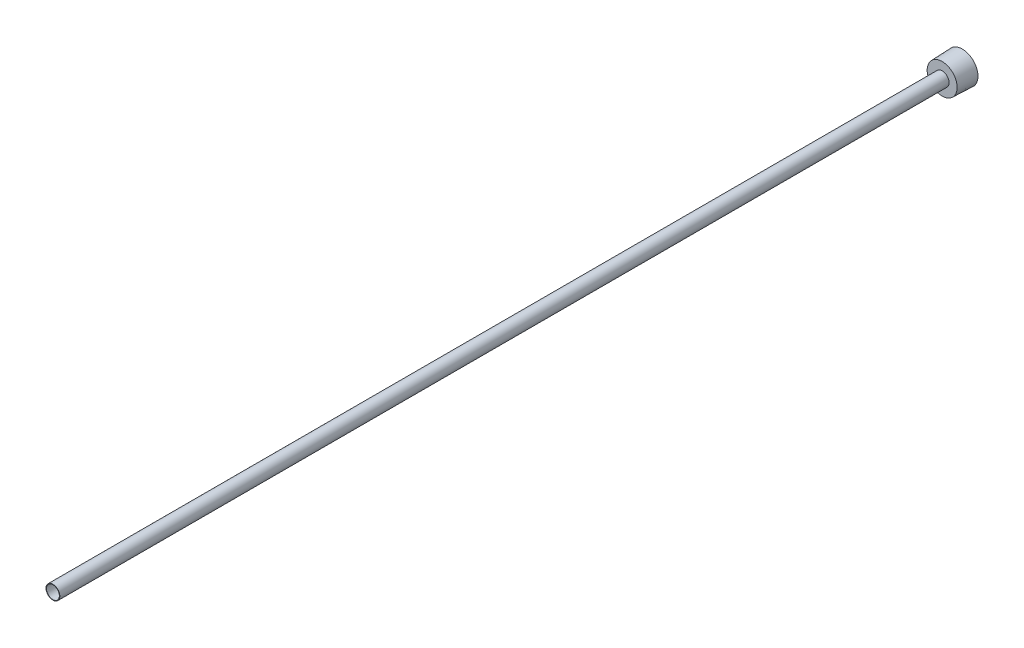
SolidWorks part; units mm, degrees
ref_plane "Front Plane" through (0, 0, 0) normal (0, 0, 1) x (1, 0, 0)
ref_plane "Top Plane" through (0, 0, 0) normal (0, 1, 0) x (1, 0, 0)
ref_plane "Right Plane" through (0, 0, 0) normal (1, 0, 0) x (0, 0, -1)
sketch "Sketch1" plane through (0, 0, 0) normal (1, 0, 0) x (0, 0, -1)
  line L0 (-223.2122, 0) -> (49776.7878, 0) construction
  line L6 (0, 10.541) -> (-13.4874, 10.049)
  line L7 (0, 0) -> (0, 10.541)
  line L8 (-13.4874, 10.049) -> (-13.4874, 4.6355)
  line L9 (-13.4874, 4.6355) -> (-609.6, 4.6355)
  line L10 (-609.6, 4.6355) -> (-609.6, 0)
  line L11 (0, 0) -> (-609.6, 0)
  dimension "D1" = 2.089
  dimension "D2" = 13.4874
  dimension "D3" = 21.082
  dimension "D4" = 9.271
  dimension "D5" = 609.6
revolve "Revolve1" add sketch "Sketch1" angle 360 about L0
sketch "Sketch2" plane through (0, 0, 609.6) normal (0, 0, 1) x (1, 0, 0)
  circle A0 centre (0, 0) radius 4.318
  dimension "D1" = 8.636
extrude "Cut-Extrude1" cut sketch "Sketch2" against normal through all
sketch "Sketch3" plane through (0, 0, 0) normal (0, 0, -1) x (-1, 0, 0)
  line L0 (0, 11.5951) -> (0, -11.5951) construction
  line L1 (0, -7.3323) -> (6.35, -3.6662)
  line L2 (6.35, -3.6662) -> (6.35, 3.6662)
  line L3 (6.35, 3.6662) -> (0, 7.3323)
  line L4 (0, 7.3323) -> (-6.35, 3.6662)
  line L5 (-6.35, 3.6662) -> (-6.35, -3.6662)
  line L6 (-6.35, -3.6662) -> (0, -7.3323)
  circle A0 centre (0, 0) radius 6.35 construction
  dimension "D1" = 12.7
extrude "Cut-Extrude2" cut sketch "Sketch3" against normal blind 9.525
